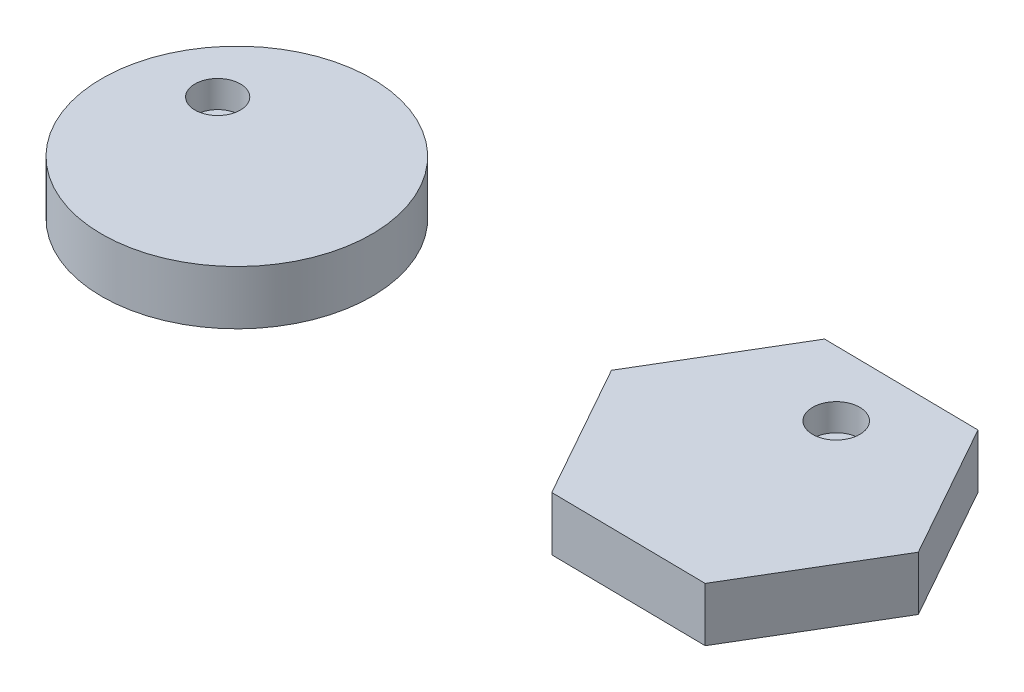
SolidWorks part; units mm, degrees
ref_plane "Front Plane" through (0, 0, 0) normal (0, 0, 1) x (1, 0, 0)
ref_plane "Top Plane" through (0, 0, 0) normal (0, 1, 0) x (1, 0, 0)
ref_plane "Right Plane" through (0, 0, 0) normal (1, 0, 0) x (0, 0, -1)
sketch "Sketch1"
  dimension "D1" = 127
extrude "Extrude1" add sketch "Sketch1" along normal blind 25.4
sketch "Sketch3"
extrude "Extrude2" add sketch "Sketch3" along normal blind 25.4
sketch "Sketch4"
sketch "Sketch5"
extrude "Extrude3" cut sketch "Sketch5" against normal blind 12.7
sketch "Sketch6"
extrude "Extrude4" cut sketch "Sketch6" against normal blind 12.7
